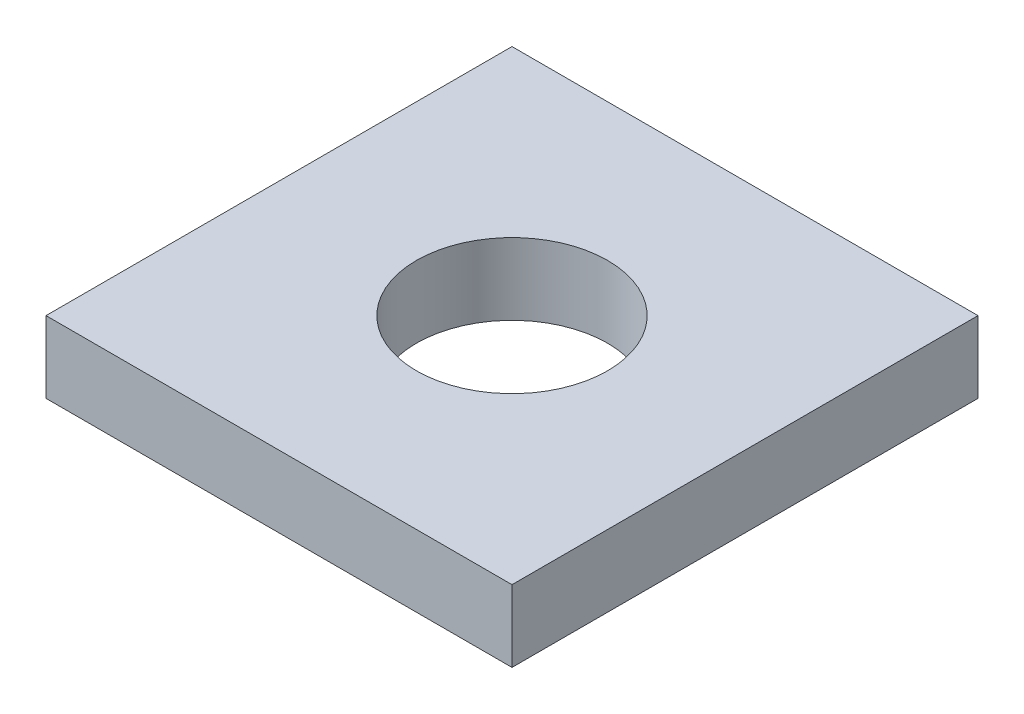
SolidWorks part; units mm, degrees
ref_plane "Front" through (0, 0, 0) normal (0, 0, 1) x (1, 0, 0)
ref_plane "Top" through (0, 0, 0) normal (0, 1, 0) x (1, 0, 0)
ref_plane "Right" through (0, 0, 0) normal (1, 0, 0) x (0, 0, -1)
sketch "Sketch1" plane through (0, 0, 0) normal (0, 1, 0) x (1, 0, 0)
  line L1 (0, 0) -> (9.75, 0)
  line L2 (0, 0) -> (0, 9.75)
  line L3 (0, 9.75) -> (9.75, 9.75)
  line L4 (9.75, 0) -> (9.75, 9.75)
  circle A0 centre (4.875, 4.875) radius 2
extrude "Boss-Extrude2" add sketch "Sketch1" along normal blind 1.5
equation "\"D2@Sketch1\"= \"D1@Sketch1\" / 2"
equation "\"D3@Sketch1\"=\"D1@Sketch1\" / 2"
